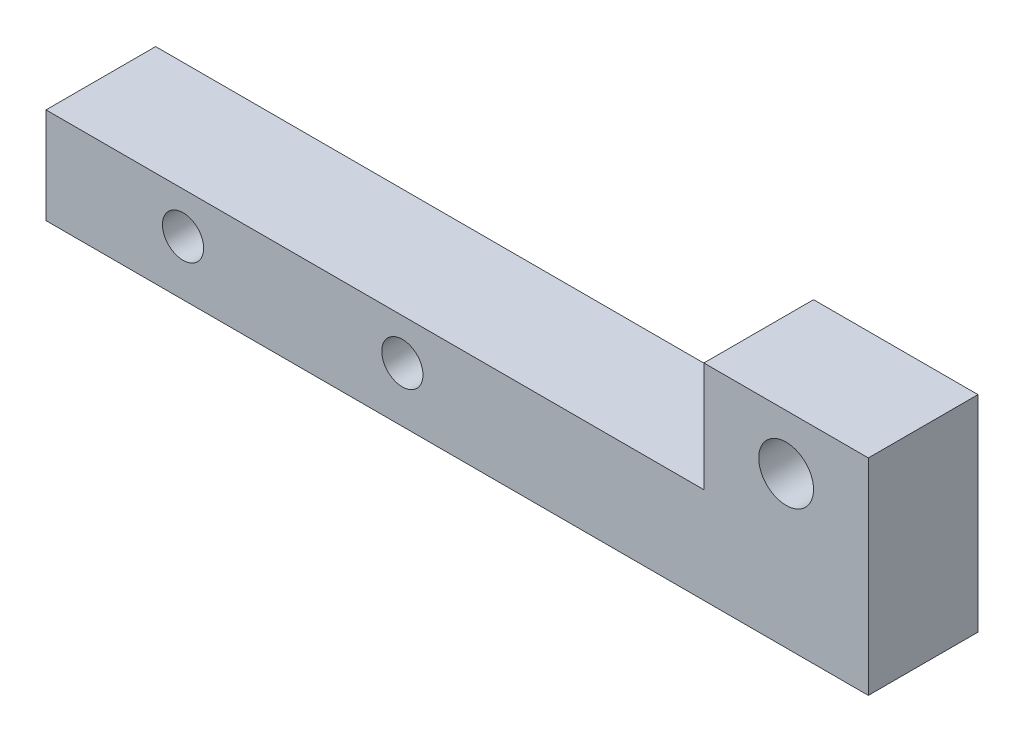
SolidWorks part; units mm, degrees
ref_plane "Front Plane" through (0, 0, 0) normal (0, 0, 1) x (1, 0, 0)
ref_plane "Top Plane" through (0, 0, 0) normal (0, 1, 0) x (1, 0, 0)
ref_plane "Right Plane" through (0, 0, 0) normal (1, 0, 0) x (0, 0, -1)
sketch "Sketch1" plane through (0, 0, 0) normal (0, 0, 1) x (1, 0, 0)
  line L0 (-15.875, 4.7625) -> (-15.875, -6.35)
  line L1 (-15.875, -6.35) -> (79.375, -6.35)
  line L2 (79.375, -6.35) -> (79.375, 17.4752)
  line L3 (79.375, 17.4752) -> (60.325, 17.4752)
  line L4 (60.325, 17.4752) -> (60.325, 4.7625)
  line L5 (60.325, 4.7625) -> (-15.875, 4.7625)
  line L6 (0, 0) -> (21.2456, 0) construction
  line L7 (69.85, 11.1252) -> (69.85, 17.4752)
  circle A0 centre (0, 0) radius 3.9624
  circle A1 centre (25.4, 0) radius 3.9624
  circle A2 centre (69.85, 11.1252) radius 3.175
  circle A3 centre (25.4, 0) radius 2.3876
  circle A4 centre (0, 0) radius 2.3876
  dimension "D2" = 7.9248
  dimension "D9" = 4.7752
  dimension "D10" = 6.35
  dimension "D3" = 15.875
  dimension "D4" = 25.4
  dimension "D5" = 95.25
  dimension "D6" = 19.05
  dimension "D7" = 23.8252
  dimension "D8" = 11.1252
  dimension "D11" = 6.35
  dimension "D12" = 4.7625
sketch "Sketch2" plane through (0, 0, 0) normal (0, 0, 1) x (1, 0, 0)
  line L0 (-15.875, -6.35) -> (79.375, -6.35) construction
  line L1 (79.375, -6.35) -> (79.375, 17.4752) construction
  line L2 (79.375, 17.4752) -> (60.325, 17.4752) construction
  line L3 (60.325, 17.4752) -> (60.325, 4.7625) construction
  line L4 (60.325, 4.7625) -> (-15.875, 4.7625) construction
  line L5 (-15.875, 4.7625) -> (-15.875, -6.35) construction
  line L6 (-15.875, -6.35) -> (79.375, -6.35)
  line L7 (79.375, -6.35) -> (79.375, 17.4752)
  line L8 (79.375, 17.4752) -> (60.325, 17.4752)
  line L9 (60.325, 17.4752) -> (60.325, 4.7625)
  line L10 (60.325, 4.7625) -> (-15.875, 4.7625)
  line L11 (-15.875, 4.7625) -> (-15.875, -6.35)
  circle A0 centre (25.4, 0) radius 2.3876 construction
  circle A1 centre (0, 0) radius 2.3876 construction
  circle A2 centre (69.85, 11.1252) radius 3.175 construction
  circle A3 centre (25.4, 0) radius 2.3876
  circle A4 centre (0, 0) radius 2.3876
  circle A5 centre (69.85, 11.1252) radius 3.175
extrude "Boss-Extrude1" add sketch "Sketch2" along normal blind 12.7
sketch "Sketch3" plane through (0, 0, 0) normal (0, 0, 1) x (1, 0, 0)
  circle A0 centre (0, 0) radius 3.9624 construction
  circle A1 centre (25.4, 0) radius 3.9624 construction
  circle A2 centre (0, 0) radius 3.9624
  circle A3 centre (25.4, 0) radius 3.9624
extrude "Cut-Extrude1" cut sketch "Sketch3" against normal blind 9.525 from offset 4.7752
